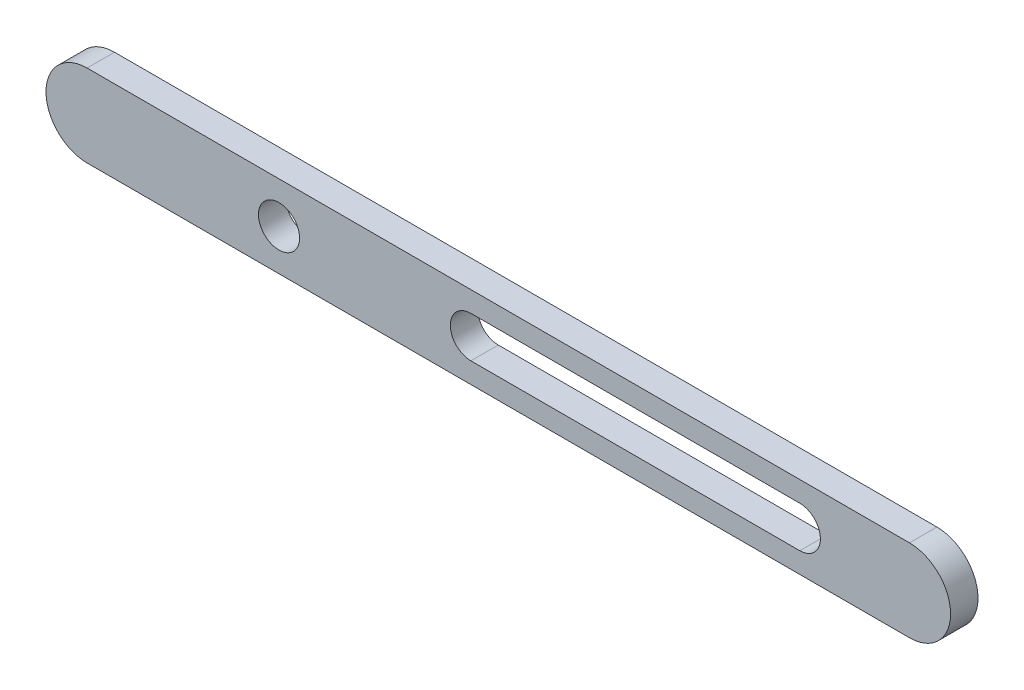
SolidWorks part; units mm, degrees
ref_plane "Front" through (0, 0, 0) normal (0, 0, 1) x (1, 0, 0)
ref_plane "Top" through (0, 0, 0) normal (0, 1, 0) x (1, 0, 0)
ref_plane "Right" through (0, 0, 0) normal (1, 0, 0) x (0, 0, -1)
sketch "Sketch1" plane through (0, 0, 0) normal (0, 0, 1) x (1, 0, 0)
  line L0 (-70, 15) -> (230, 15)
  line L1 (230, -15) -> (-70, -15)
  line L2 (70, 0) -> (190, 0) construction
  line L3 (70, -7.5) -> (190, -7.5)
  line L4 (70, 7.5) -> (190, 7.5)
  circle A0 centre (0, 0) radius 7.5
  arc A1 (230, 15) -> (230, -15) centre (230, 0) cw
  arc A2 (-70, -15) -> (-70, 15) centre (-70, 0) cw
  arc A3 (70, -7.5) -> (70, 7.5) centre (70, 0) cw
  arc A4 (190, -7.5) -> (190, 7.5) centre (190, 0) ccw
  dimension "D1" = 15
  dimension "D2" = 15
  dimension "D3" = 300
  dimension "D4" = 70
  dimension "D7" = 70
  dimension "D8" = 120
  dimension "D5" = 7.5
  dimension "D6" = 7.5
extrude "Extrude1" add sketch "Sketch1" against normal blind 10
